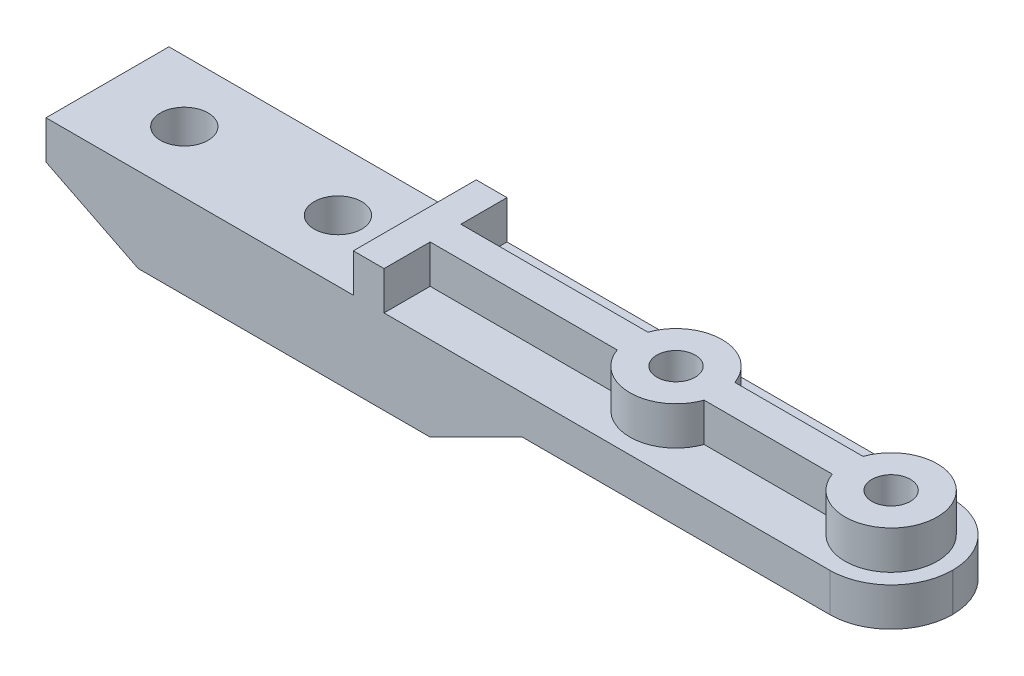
SolidWorks part; units mm, degrees
ref_plane "Face" through (0, 0, 0) normal (0, 0, 1) x (1, 0, 0)
ref_plane "Dessus" through (0, 0, 0) normal (0, 1, 0) x (1, 0, 0)
ref_plane "Droite" through (0, 0, 0) normal (1, 0, 0) x (0, 0, -1)
sketch "Esquisse1" plane through (0, 0, 0) normal (0, 0, 1) x (1, 0, 0)
  line L0 (-50, 0) -> (13.1474, 0) construction
  line L1 (-50, 2.5) -> (11.6451, 2.5) construction
  line L2 (0, 6.9334) -> (0, -5.8356) construction
  line L3 (7, 5.3734) -> (7, -3.4089) construction
  line L4 (11, 2.8311) -> (11, -2.6) construction
  line L5 (-11, 3.64) -> (-11, -1.8489) construction
  line L6 (-1.7, 6.9334) -> (-1.7, -6.2978) construction
  line L7 (-44, 5.3734) -> (-44, -5.3046) construction
  line L8 (-44, 2.5) -> (11, 2.5)
  line L9 (-44, 2.5) -> (-44, 0)
  line L10 (-44, 0) -> (11, 0)
  line L11 (1.7, 6.9334) -> (1.7, -5.8356) construction
  line L12 (11, 2.5) -> (11, 0)
  line L16 (-24, 6.9334) -> (-24, -7.0143) construction
  line L17 (-34, 5.3734) -> (-34, -5.3046) construction
extrude "Base-Extrusion" add sketch "Esquisse1" along normal mid plane 8
sketch "Esquisse2" plane through (0, 0, 0) normal (0, 1, 0) x (1, 0, 0)
  line L0 (-11.5357, 0) -> (11.7319, 0) construction
  line L1 (7, 4.6094) -> (7, -5.9824) construction
  line L2 (0, 5.3694) -> (0, -7.6251) construction
  line L3 (-24, 6.6034) -> (-24, -8.0927) construction
  line L4 (-44, 3.1773) -> (-44, -11.9696) construction
  line L5 (-44, -4) -> (-44, 4) construction
  line L6 (-29, 6.6034) -> (-29, -5.1174) construction
  line L7 (-22, 5.3694) -> (-22, -5.9824) construction
  line L8 (-23.0127, 1) -> (7.7662, 1) construction
  line L9 (-23.0127, -1) -> (7.3765, -1) construction
  line L10 (-9.8284, 1) -> (-22, 1)
  line L11 (-13.9206, 4) -> (-39.5335, 4) construction
  line L12 (11, 4) -> (-44, 4) construction
  line L13 (-16.079, -4) -> (-38.555, -4) construction
  line L14 (-44, -4) -> (11, -4) construction
  line L15 (-24, -4) -> (-22, -4)
  line L16 (11, -4) -> (-44, -4) construction
  line L17 (-22, -1) -> (-9.8284, -1)
  line L18 (-22, 1) -> (-22, 4)
  line L19 (-22, 4) -> (-24, 4)
  line L20 (-24, 4) -> (-24, -4)
  line L21 (-22, -4) -> (-22, -1)
  line L22 (-4.1716, 1) -> (4.1716, 1)
  line L23 (-4.1716, -1) -> (4.1716, -1)
  arc A0 (-4.1716, 1) -> (-9.8284, 1) centre (-7, 0) ccw
  arc A2 (-9.8284, -1) -> (-4.1716, -1) centre (-7, 0) ccw
  arc A3 (4.1716, -1) -> (4.1716, 1) centre (7, 0) ccw
fillet "Congé1" radius 3.99 2 edges at (11, 1.25, 4) (11, 1.25, -4)
extrude "Extrusion1" add sketch "Esquisse2" along normal blind 5
sketch "Esquisse3" plane through (0, 0, 0) normal (0, -1, 0) x (1, 0, 0)
  circle A0 centre (7, 0) radius 1.25
  circle A1 centre (-7, 0) radius 1.25
  circle A2 centre (-29, 0) radius 1.55
  circle A3 centre (-39, 0) radius 1.55
extrude "Enlèv. mat.-Extru.1" cut sketch "Esquisse3" against normal through all
sketch "Esquisse4" plane through (0, 0, 0) normal (0, -1, 0) x (1, 0, 0)
  line L0 (-46.9966, 4) -> (11.2315, 4) construction
  line L1 (-44, 6.1535) -> (-44, -7.4547) construction
  line L2 (-46.9966, 3) -> (-0.5876, 3) construction
  line L3 (-46.5628, 0) -> (14.2134, 0) construction
  line L4 (-13, 7.0752) -> (-13, -7.4547) construction
  line L5 (-22, 4) -> (-22, -9.027) construction
  line L6 (-44, -3) -> (-44, -4)
  line L7 (-13, 3) -> (-44, 3)
  line L8 (-13, 3) -> (-13, 4)
  line L9 (-13, 4) -> (-44, 4)
  line L10 (-44, 3) -> (-44, 4)
  line L11 (-13, -4) -> (-44, -4)
  line L12 (-13, -3) -> (-13, -4)
  line L13 (-13, -3) -> (-44, -3)
extrude "Extrusion2" add sketch "Esquisse4" along normal blind 3
chamfer "Chanfrein1" distance 3 distance2 6 6 edges at (-13, -1.5, -3) (-13, -1.5, -4) (-13, -3, -3.5) (-13, -1.5, 3) (-13, -1.5, 4) (-13, -3, 3.5)
chamfer "Chanfrein2" distance 3 distance2 6 4 edges at (-44, -3, 3.5) (-44, -1.5, -3) (-44, -3, -3.5) (-44, -1.5, 3)
